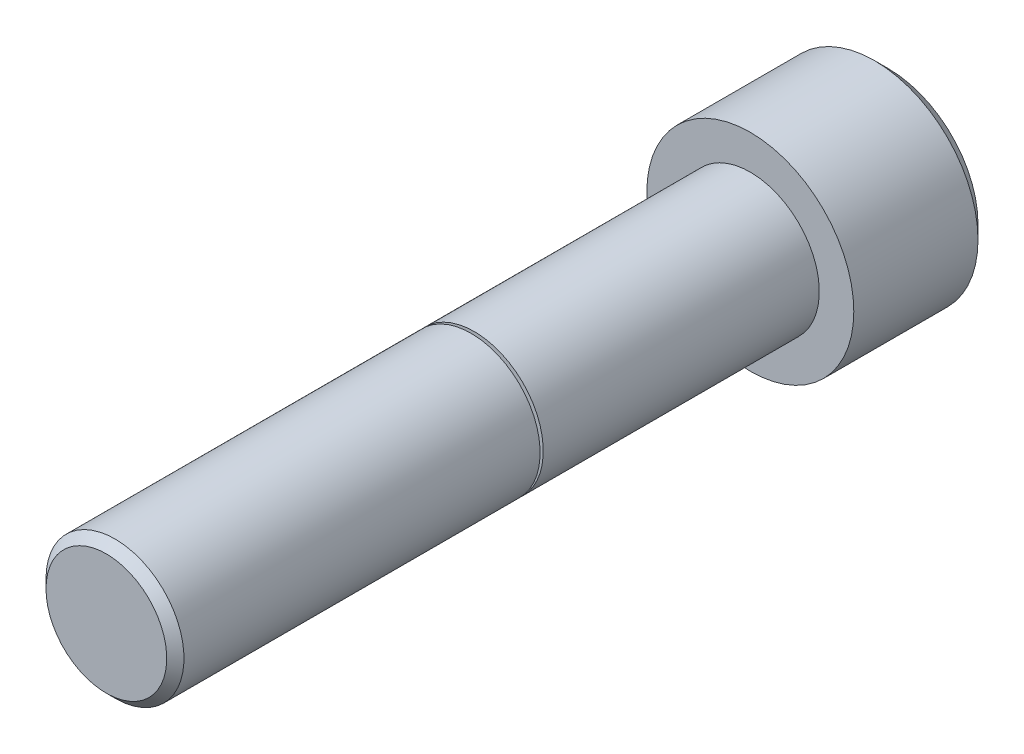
SolidWorks part; units mm, degrees
ref_plane "Front" through (0, 0, 0) normal (0, 0, 1) x (1, 0, 0)
ref_plane "Top" through (0, 0, 0) normal (0, 1, 0) x (1, 0, 0)
ref_plane "Right" through (0, 0, 0) normal (1, 0, 0) x (0, 0, -1)
sketch "Logo3_Revol_Axis" plane through (0, 0, 0) normal (0, 1, 0) x (1, 0, 0)
  line L0 (0, -43.5172) -> (0, 43.5172) construction
sketch "Logo3_bib1" plane through (0, 0, 0) normal (0, -1, 0) x (-1, 0, 0)
  line L0 (0, -88.9) -> (0, 19.05)
  line L1 (0, 19.05) -> (12.3825, 19.05)
  line L2 (14.2875, 17.145) -> (14.2875, 0)
  line L3 (14.2875, 0) -> (9.525, 0)
  line L4 (9.525, 0) -> (9.525, -38.11)
  line L5 (9.525, -87.7087) -> (8.3337, -88.9)
  line L6 (8.3337, -88.9) -> (0, -88.9)
  line L7 (9.525, -38.11) -> (8.4472, -38.11)
  line L8 (8.4403, -38.1488) -> (9.525, -38.5436)
  line L9 (9.525, -38.5436) -> (9.525, -87.7087)
  line L10 (0, 10.5852) -> (0, -63.2873) construction
  line L11 (12.3825, 19.05) -> (14.2875, 17.145)
  arc A1 (8.4472, -38.11) -> (8.4403, -38.1488) centre (8.4472, -38.13) ccw
  point P17 (8.3337, -38.11)
  point P19 (14.2875, 19.05)
revolve "Revolve1" add sketch "Logo3_bib1" angle 360 about L10
sketch "Logo3_bib2" plane through (0, 0, -19.05) normal (0, 0, -1) x (1, 0, 0)
  line L1 (9.1654, 0) -> (4.5827, 7.9375)
  line L2 (4.5827, 7.9375) -> (-4.5827, 7.9375)
  line L3 (-4.5827, 7.9375) -> (-9.1654, 0)
  line L4 (-9.1654, 0) -> (-4.5827, -7.9375)
  line L5 (-4.5827, -7.9375) -> (4.5827, -7.9375)
  line L6 (4.5827, -7.9375) -> (9.1654, 0)
  circle A0 centre (0, 0) radius 7.9375 construction
  dimension "Logo3_c1" = 15.875
extrude "Cut-Extrude1" cut sketch "Logo3_bib2" against normal blind 9.525
equation "\"DIA2@Logo3_bib1\" = \"Logo3_d1-pas@Logo3_bib1\""
equation "\"LGT1@Logo3_bib1\" = \"Logo3_d1@Logo3_bib1\""
equation "\"D1@Cut-Extrude1\" = \"Logo3_d1@Logo3_bib1\"/2."
equation "\"D2@Cosmetic Thread1\" = \"Logo3_d1-pas@Logo3_bib1\""
equation "\"D5@Logo3_bib1\"=\"Logo3_d1@Logo3_bib1\"*.1"
